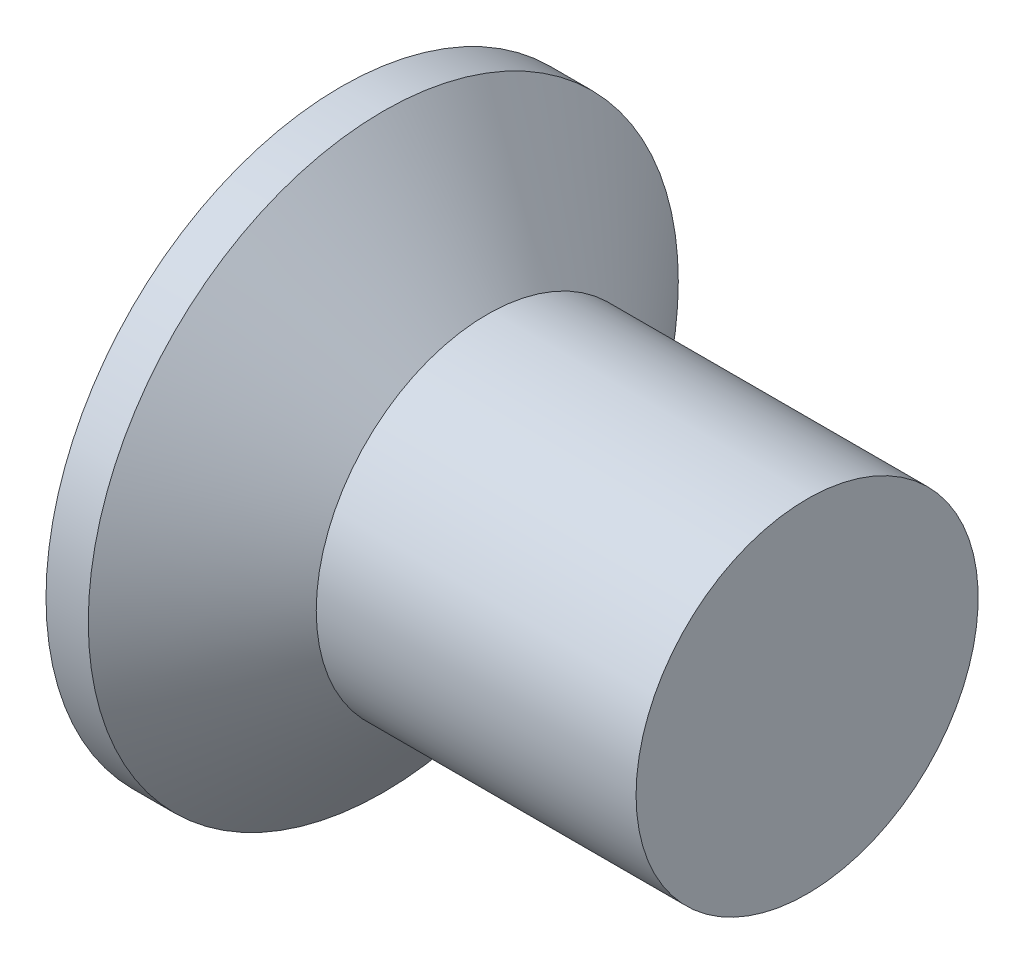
SolidWorks part; units mm, degrees
ref_plane "Plane1" through (0, 0, 0) normal (0, 0, 1) x (1, 0, 0)
ref_plane "Plane2" through (0, 0, 0) normal (0, 1, 0) x (1, 0, 0)
ref_plane "Plane3" through (0, 0, 0) normal (1, 0, 0) x (0, 0, -1)
sketch "BodySke" plane through (0, 0, 0) normal (0, 0, 1) x (1, 0, 0)
  line L0 (0, 0) -> (0, 3.0226)
  line L1 (0, 3.0226) -> (0.4329, 3.0226)
  line L2 (1.4986, 1.7526) -> (4.7752, 1.7526)
  line L3 (4.7752, 1.7526) -> (4.7752, 0)
  line L4 (4.7752, 0) -> (0, 0)
  line L5 (-6.35, 0) -> (82.55, 0) construction
  line L6 (1.4986, -1.7526) -> (4.7752, -1.7526) construction
  line L7 (0.4329, -3.0226) -> (1.4986, -1.7526) construction
  line L8 (0.4329, 3.0226) -> (1.4986, 1.7526)
  line L9 (0, -3.0226) -> (0.4329, -3.0226) construction
  line L10 (2.2911, 3.3401) -> (2.2911, -6.1849) construction
  line L11 (0, 6.35) -> (0, -3.175) construction
  dimension "Diameter" = 3.5052
  dimension "Length" = 4.7752
  dimension "Head_ht" = 1.4986
  dimension "Head_dia" = 6.0452
  dimension "Head_ang" = 100
  dimension "D6" = 0.4329
  dimension "Advance" = 0.7925
  dimension "Thread_nom" = 4.7752
revolve "Base-Revolve" add sketch "BodySke" angle 360 about L5
sketch "Sketch2" plane through (0, 0, 0) normal (-1, 0, 0) x (0, 0, 1)
  line L0 (-3.0226, -0.6096) -> (3.0226, -0.6096)
  line L1 (-3.0226, -0.6096) -> (-3.0226, 0.6096)
  line L2 (3.0226, 0.6096) -> (-3.0226, 0.6096)
  line L3 (3.0226, 0.6096) -> (3.0226, -0.6096)
  dimension "D1" = 0.6096
  dimension "Slot_width" = 1.2192
  dimension "D2" = 6.0452
  dimension "D3" = 3.0226
extrude "Slot" [suppressed] cut sketch "Sketch2" against normal blind 0.762
sketch "Sketch3" plane through (0, 0, 0) normal (-1, 0, 0) x (0, 0, 1)
  line L0 (-0.4191, 2.0574) -> (0.4191, 2.0574)
  line L1 (0.4191, 2.0574) -> (0.4191, -2.0574)
  line L2 (0.4191, -2.0574) -> (-0.4191, -2.0574)
  line L3 (-0.4191, -2.0574) -> (-0.4191, 2.0574)
  dimension "D1" = 2.0574
  dimension "Cross_dia" = 4.1148
  dimension "D2" = 0.4191
  dimension "Cross_width" = 0.8382
ref_plane "Plane4" through (2.6924, 0, 0) normal (-1, 0, 0) x (0, 0, 1)
sketch "Sketch4" plane through (2.6924, 0, 0) normal (-1, 0, 0) x (0, 0, 1)
  line L0 (-0.2095, 0.2095) -> (0.2096, 0.2095)
  line L3 (0.2096, 0.2095) -> (0.2096, -0.2095)
  line L4 (0.2096, -0.2095) -> (-0.2095, -0.2095)
  line L5 (-0.2095, -0.2095) -> (-0.2095, 0.2095)
  dimension "D1" = 0.4191
  dimension "D2" = 0.4191
  dimension "D3" = 0.2095
  dimension "D4" = 0.2095
loft "Cross" cut profiles "Sketch3", "Sketch4"
pattern_circular "CirPattern1" count 2 every 90 about axis through (0, 0, 0) along (1, 0, 0) of "Cross"
sketch "ThdSchSke" plane through (0, 0, 0) normal (0, 0, 1) x (1, 0, 0)
  line L0 (2.2911, -1.2802) -> (1.9603, -1.7526)
  line L1 (2.2911, -1.2802) -> (2.6219, -1.7526)
  line L2 (2.6219, -1.7526) -> (2.6219, -2.1908)
  line L3 (-3.175, 0) -> (5.1513, 0) construction
  line L5 (2.6219, -2.1908) -> (1.9603, -2.1908)
  line L6 (1.9603, -2.1908) -> (1.9603, -1.7526)
  line L7 (0, 3.0226) -> (0, -3.0226) construction
  dimension "Thread_minor" = 2.5603
  dimension "Diameter" = 3.5052
  dimension "Start" = 2.2911
  dimension "SideAngle" = 55
  dimension "VeeAngle" = 70
  dimension "Overcut" = 4.3815
revolve "ThreadSchematic" [suppressed] cut sketch "ThdSchSke" angle 360 about L3
pattern_linear "ThdSchPat" [suppressed]
equation "\"D1@Sketch3\" = \"Cross_dia@Sketch3\" / 2"
equation "\"D2@Sketch3\" = \"Cross_width@Sketch3\" / 2"
equation "\"D1@Sketch4\" = \"Cross_width@Sketch3\" *.5"
equation "\"D2@Sketch4\" = \"D1@Sketch4\""
equation "\"D4@Sketch4\" = \"D2@Sketch4\" / 2"
equation "\"D3@Sketch4\" = \"D1@Sketch4\" / 2"
equation "\"D1@Sketch2\" = \"Slot_width@Sketch2\" / 2"
equation "\"D2@Sketch2\" = \"Head_dia@BodySke\""
equation "\"D3@Sketch2\" = \"D2@Sketch2\" / 2"
equation "\"Thread_length@ThreadCosmetic\" = ((sgn( (\"Length@BodySke\" - \"Advance@BodySke\" - \"Head_ht@BodySke\" ) - \"Thread_nom@BodySke\" )-1)*( (\"Length@BodySke\" - \"Advance@BodySke\" - \"Head_ht@BodySke\" ) - \"Thread_"
equation "\"Thread_minor@ThdSchSke\" = \"Thread_minor@ThreadCosmetic\""
equation "\"Diameter@ThdSchSke\" = \"Diameter@BodySke\""
equation "\"Overcut@ThdSchSke\" = \"Diameter@BodySke\" * 1.25"
equation "\"Start@ThdSchSke\" = 0.000001 + \"Length@BodySke\" - \"Thread_length@ThreadCosmetic\"  '---Countersunk---"
equation "\"Num_threads@ThdSchPat\" = int( \"Thread_length@ThreadCosmetic\" / \"Advance@BodySke\" + 0.999 )  + 1"
equation "\"Advance@ThdSchPat\" = \"Thread_length@ThreadCosmetic\" /  (\"Num_threads@ThdSchPat\" - 1) 'relax it"
